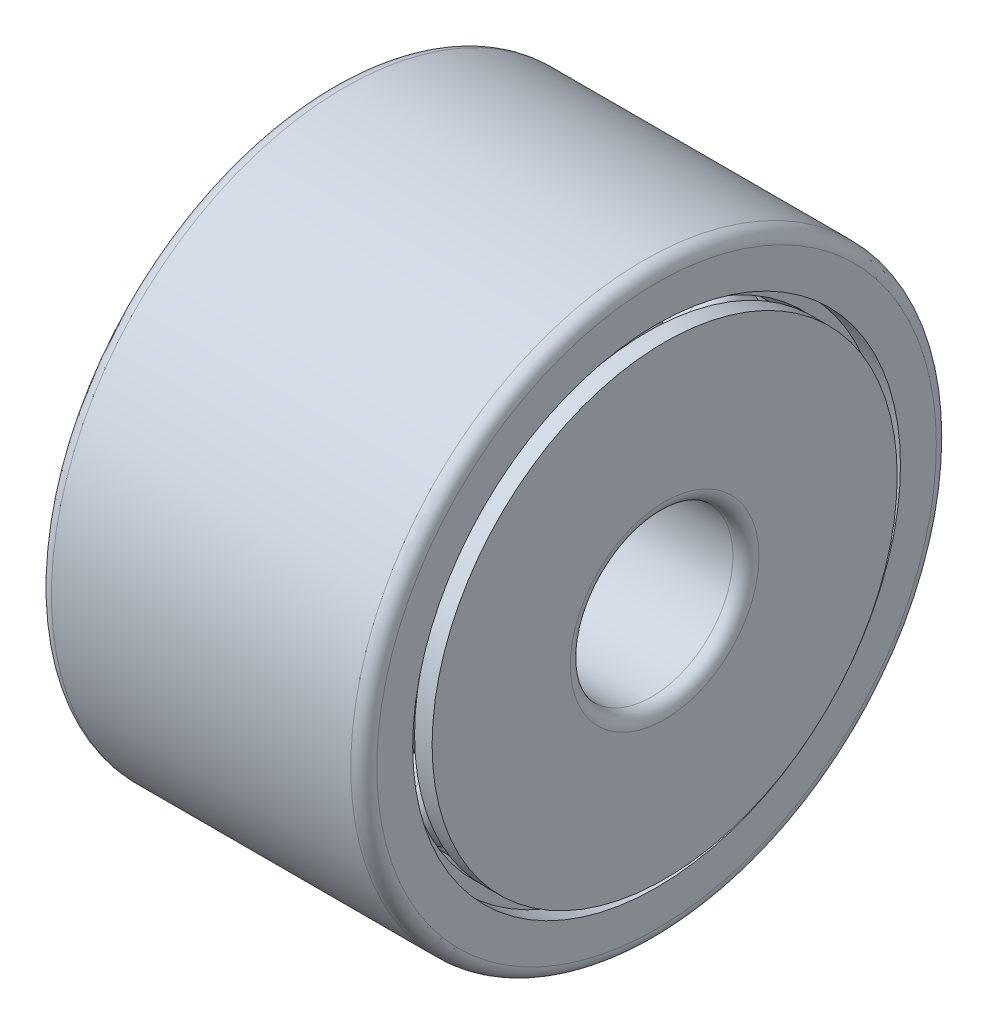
SolidWorks part; units mm, degrees
ref_plane "Plane1" through (0, 0, 0) normal (0, 0, 1) x (1, 0, 0)
ref_plane "Plane2" through (0, 0, 0) normal (0, 1, 0) x (1, 0, 0)
ref_plane "Plane3" through (0, 0, 0) normal (1, 0, 0) x (0, 0, -1)
sketch "Clipboard" plane through (0, 0, 0) normal (0, 0, 1) x (1, 0, 0)
  line L0 (-10, 0) -> (10, 0) construction
  line L1 (0, 0) -> (27.0344, -5.7463)
  line L2 (0, 0) -> (22.4793, 28.7722)
  line L3 (0, 0) -> (27.9428, -35.7651)
  line L4 (0, 0) -> (-22.3471, -0.7804)
sketch "OutRacSke" plane through (0, 0, 0) normal (0, 0, 1) x (1, 0, 0)
  line L0 (-14.0229, 22.6933) -> (-14.0229, 23.8026)
  line L1 (-14.0229, 23.8026) -> (-15.875, 23.8026)
  line L2 (-15.875, 23.8026) -> (-15.875, 27.305)
  line L3 (-14.605, 28.575) -> (14.605, 28.575)
  line L4 (15.875, 27.305) -> (15.875, 23.8026)
  line L5 (15.875, 23.8026) -> (14.0229, 23.8026)
  line L6 (14.0229, 23.8026) -> (14.0229, 22.6933)
  line L7 (14.0229, 22.6933) -> (-14.0229, 22.6933)
  line L8 (-7.9375, 0) -> (7.9375, 0) construction
  arc A0 (-15.875, 27.305) -> (-14.605, 28.575) centre (-14.605, 27.305) cw
  arc A1 (14.605, 28.575) -> (15.875, 27.305) centre (14.605, 27.305) cw
revolve "OuterRace" add sketch "OutRacSke" angle 360 about L8
sketch "RolDetSke" plane through (0, 0, 0) normal (0, 0, 1) x (1, 0, 0)
  line L0 (-14.0229, 20.9261) -> (-14.0229, 18.2562)
  line L1 (-14.0229, 18.2562) -> (14.0229, 18.2562)
  line L2 (14.0229, 18.2562) -> (14.0229, 20.9261)
  line L3 (12.243, 22.706) -> (-12.243, 22.706)
  line L4 (-28.575, 18.2562) -> (28.575, 18.2562) construction
  arc A0 (14.0229, 20.9261) -> (12.243, 22.706) centre (12.243, 20.9261) ccw
  arc A1 (-12.243, 22.706) -> (-14.0229, 20.9261) centre (-12.243, 20.9261) ccw
revolve "RollerDetailed" add sketch "RolDetSke" angle 360 about L4
ref_axis "Axis1" through (-50, 0, 0) along (1, 0, 0)
pattern_circular "RollersDetailed" count 12 every 30 about axis through (-50, 0, 0) along (1, 0, 0) of "RollerDetailed"
sketch "RolSimSke" plane through (0, 25.4, 0) normal (0, 0, 1) x (1, 0, 0)
  line L0 (-14.0229, -4.4612) -> (-14.0229, -9.8009)
  line L1 (-25.4, -25.4) -> (25.4, -25.4) construction
  line L2 (14.0229, -9.8009) -> (14.0229, -4.4612)
  line L3 (12.243, -2.6813) -> (-12.243, -2.6813)
  line L5 (12.243, -11.5808) -> (-12.243, -11.5808)
  arc A0 (14.0229, -4.4612) -> (12.243, -2.6813) centre (12.243, -4.4612) ccw
  arc A1 (-12.243, -2.6813) -> (-14.0229, -4.4612) centre (-12.243, -4.4612) ccw
  arc A2 (14.0229, -9.8009) -> (12.243, -11.5808) centre (12.243, -9.8009) cw
  arc A3 (-12.243, -11.5808) -> (-14.0229, -9.8009) centre (-12.243, -9.8009) cw
revolve "RollersSimplified" [suppressed] add sketch "RolSimSke" angle 360 about L1
sketch "InsRacSke" plane through (0, 0, 0) normal (0, 0, 1) x (1, 0, 0)
  line L0 (-14.949, 13.8192) -> (-14.949, 22.6933)
  line L1 (-14.949, 22.6933) -> (-16.6624, 22.6933)
  line L2 (-16.6624, 22.6933) -> (-16.6624, 9.2075)
  line L3 (-15.3924, 7.9375) -> (-0.84, 7.9375)
  line L4 (0.84, 7.9375) -> (15.3924, 7.9375)
  line L5 (16.6624, 9.2075) -> (16.6624, 22.6933)
  line L6 (16.6624, 22.6933) -> (14.949, 22.6933)
  line L7 (14.949, 22.6933) -> (14.949, 13.8192)
  line L8 (14.949, 13.8192) -> (-14.949, 13.8192)
  line L9 (-7.9375, 0) -> (7.9375, 0) construction
  arc A0 (-16.6624, 9.2075) -> (-15.3924, 7.9375) centre (-15.3924, 9.2075) ccw
  arc A1 (-0.84, 7.9375) -> (0.84, 7.9375) centre (0, 6.985) cw
  arc A2 (15.3924, 7.9375) -> (16.6624, 9.2075) centre (15.3924, 9.2075) ccw
revolve "InnerRace" add sketch "InsRacSke" angle 360 about L9
equation "\"halfWidth@OutRacSke\" =  \"Width@OutRacSke\" / 2"
equation "\"CLdia@Clipboard\" =  ( \"Race_OD@Clipboard\" + \"Race_ID@Clipboard\" )  / 2"
equation "\"CLRad@RolDetSke\" = ( \"Race_OD@Clipboard\" + \"Race_ID@Clipboard\" )  / 4"
equation "\"Roller_diameter@RolDetSke\" =  ( \"Race_OD@Clipboard\" -  \"Race_ID@Clipboard\" )  / 2 + .001"
equation "\"Roller_diameter@RolSimSke\" = ( \"Race_OD@Clipboard\" -  \"Race_ID@Clipboard\" )  / 2 + .001"
equation "\"radius@RolDetSke\" = \"Roller_diameter@RolDetSke\" / 5"
equation "\"radius@RolSimSke\" = \"Roller_diameter@RolSimSke\" / 5"
equation "\"Cyl_Len@OutRacSke\" = \"Cyl_Len@RolDetSke\""
equation "\"Cyl_Len@RolSimSke\" = \"Cyl_Len@RolDetSke\""
equation "\"halfCylLen@RolDetSke\" = \"Cyl_Len@RolDetSke\" / 2"
equation "\"offset@InsRacSke\" = \"radius@InsRacSke\" * 0.75"
equation "\"SlotWidth@InsRacSke\" =  ( \"Width@OutRacSke\" + \"Cyl_Len@RolDetSke\" )  / 2"
equation "\"halfSlotWidth@InsRacSke\" = \"SlotWidth@InsRacSke\" / 2"
equation "\"D1@OutRacSke\" = \"Cyl_Len@OutRacSke\" / 2"
equation "\"Max_count@Clipboard\" = int( 3.14159265 / atn(( \"Roller_diameter@RolDetSke\" / 2) / sqr( \"CLRad@RolDetSke\"  *  \"CLRad@RolDetSke\" - ( \"Roller_diameter@RolDetSke\" / 2) *  ( \"Roller_diameter@RolDetSke\" / "
equation "\"Max_count@Clipboard\" = ((sgn( \"Max_count@Clipboard\" - \"Count@Clipboard\" )-1)*( \"Max_count@Clipboard\" - \"Count@Clipboard\" ))/-2+ \"Count@Clipboard\""
equation "\"Count@RollersDetailed\" = int( \"Show_count@Clipboard\" ) "
equation "\"Count@RollersDetailed\" = ((sgn( \"Count@RollersDetailed\" - \"Max_count@Clipboard\" )-1)*( \"Count@RollersDetailed\" - \"Max_count@Clipboard\" ))/-2+ \"Max_count@Clipboard\""
equation "\"Count@RollersDetailed\" = ((sgn( \"Count@RollersDetailed\" - \"Min_count@Clipboard\" )+1)*( \"Count@RollersDetailed\" - \"Min_count@Clipboard\"))/2 +\"Min_count@Clipboard\""
equation "\"Angle@RollersDetailed\" = 360.0 / \"Max_count@Clipboard\""
equation "\"Bore@RolSimSke\" = \"Race_ID@Clipboard\""
equation "\"Race_ID@InsRacSke\" = \"Race_ID@Clipboard\""
equation "\"Race_OD@InsRacSke\" = \"Race_OD@Clipboard\""
equation "\"halfWidth@InsRacSke\" = \"Width_IR@InsRacSke\" / 2"
equation "\"halfLength@RolSimSke\" = \"Cyl_Len@RolSimSke\" / 2"
equation "\"Race_OD@OutRacSke\" = \"Race_OD@Clipboard\""
